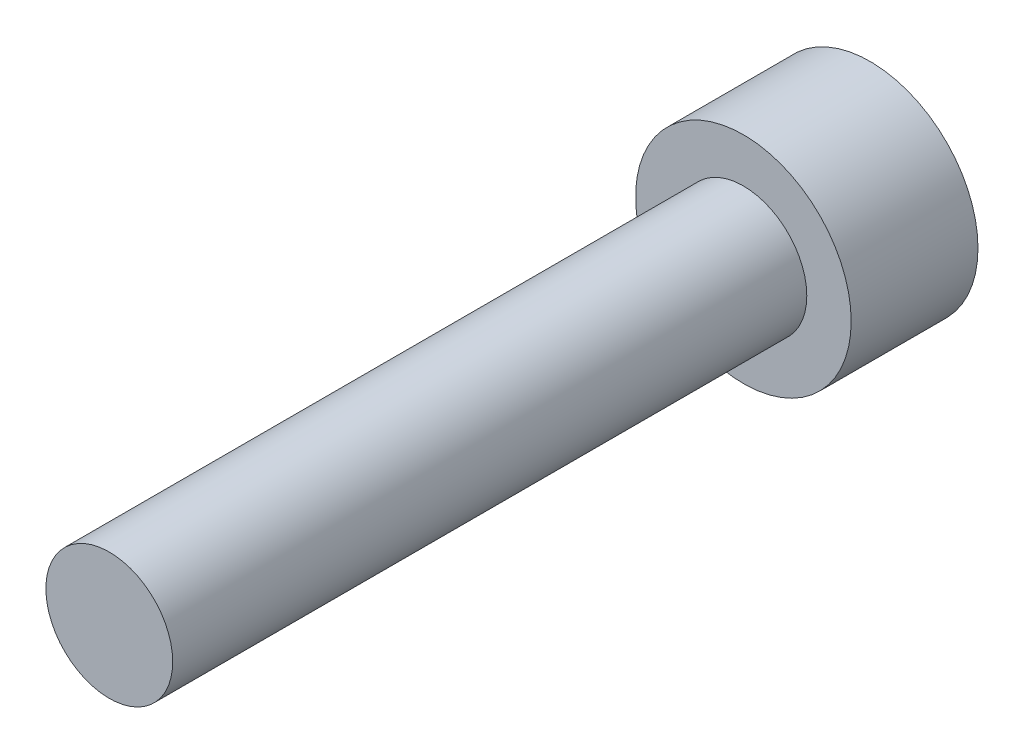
SolidWorks part; units mm, degrees
ref_plane "Front Plane" through (0, 0, 0) normal (0, 0, 1) x (1, 0, 0)
ref_plane "Top Plane" through (0, 0, 0) normal (0, 1, 0) x (1, 0, 0)
ref_plane "Right Plane" through (0, 0, 0) normal (1, 0, 0) x (0, 0, -1)
sketch "Sketch6" plane through (0, 0, 0) normal (1, 0, 0) x (0, 0, -1)
  line L0 (-25, 0) -> (22.525, 0) construction
  line L1 (4.675, 0) -> (-4.675, 0) construction
  line L2 (-25, 0) -> (-25, -2.5)
  line L3 (-25, -2.5) -> (0, -2.5)
  line L4 (0, 4.675) -> (0, -4.675) construction
  line L5 (0, -2.5) -> (0, -4.25)
  line L6 (0, -4.25) -> (5, -4.25)
  line L7 (5, -4.25) -> (5, 0)
  line L8 (5, 0) -> (-25, 0)
  dimension "L" = 25
  dimension "H" = 5
  dimension "A" = 8.5
  dimension "D" = 5
revolve "Revolve1" add sketch "Sketch6" angle 360 about L0
sketch "Sketch7" plane through (0, 0, -5) normal (0, 0, -1) x (-1, 0, 0)
  line L2 (-2, 1.1547) -> (-2, -1.1547)
  line L4 (-2, -1.1547) -> (0, -2.3094)
  line L5 (0, -2.3094) -> (2, -1.1547)
  line L6 (2, -1.1547) -> (2, 1.1547)
  line L7 (2, 1.1547) -> (0, 2.3094)
  line L8 (0, 2.3094) -> (-2, 1.1547)
  circle A0 centre (0, 0) radius 2 construction
  dimension "J" = 4
extrude "HEX" cut sketch "Sketch7" against normal blind 4
